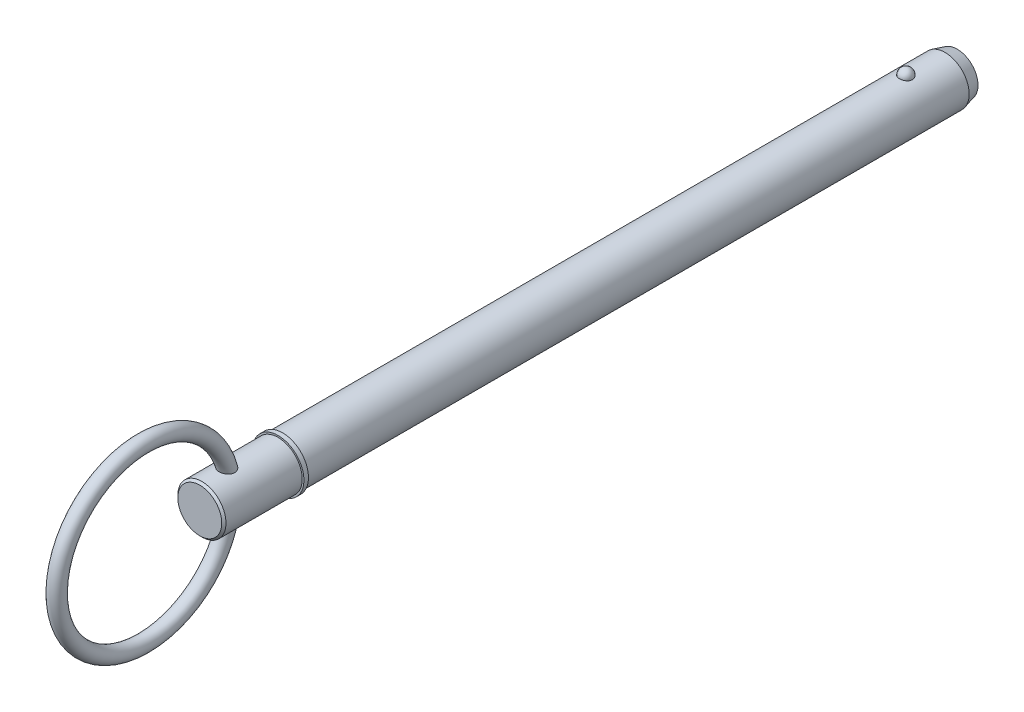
SolidWorks part; units mm, degrees
ref_plane "Front Plane" through (0, 0, 0) normal (0, 0, 1) x (1, 0, 0)
ref_plane "Top Plane" through (0, 0, 0) normal (0, 1, 0) x (1, 0, 0)
ref_plane "Right Plane" through (0, 0, 0) normal (1, 0, 0) x (0, 0, -1)
sketch "Sketch2" plane through (0, 0, 0) normal (0, 0, 1) x (1, 0, 0)
  circle A0 centre (0, 0) radius 7.94
  point P3 (0, 7.94)
  dimension "D1" = 15.88
extrude "Boss-Extrude1" add sketch "Sketch2" along normal blind 203.2
sketch "Sketch3" plane through (0, 0, 0) normal (0, 0, -1) x (-1, 0, 0)
  circle A0 centre (0, 0) radius 7.94
  dimension "D1" = 15.88
extrude "Boss-Extrude2" add sketch "Sketch3" along normal blind 19.05
chamfer "Chamfer1" distance 4 angle 15 1 edges at (-7.94, 0, -19.05)
sketch "Sketch18" plane through (0, 0, 0) normal (1, 0, 0) x (0, 0, -1)
  line L0 (15.05, 7.94) -> (-203.2, 7.94) construction
  line L1 (2.15, 10.09) -> (2.15, 5.79)
  line L2 (-203.2, -7.94) -> (15.05, -7.94) construction
  arc A0 (2.15, 10.09) -> (2.15, 5.79) centre (2.15, 7.94) ccw
  point P4 (0, 7.94)
  dimension "D1" = 18.03
revolve "Revolve1" add sketch "Sketch18" angle 360 about L1
sketch "Sketch19" plane through (0, 0, 0) normal (1, 0, 0) x (0, 0, -1)
  line L0 (-33.7288, 0) -> (-46.4542, 0) construction
sketch "Sketch20" plane through (0, 0, 0) normal (1, 0, 0) x (0, 0, -1)
  line L0 (-203.2, 0) -> (-203.2, 8.5)
  line L1 (-203.2, 7.94) -> (-203.2, -7.94) construction
  line L2 (-203.2, 8.5) -> (-204.7, 8.5)
  line L3 (-204.7, 8.5) -> (-204.7, 0)
  line L4 (-33.7288, 0) -> (-46.4542, 0) construction
  line L5 (-204.7, 0) -> (-203.2, 0)
  dimension "D1" = 8.5
  dimension "D2" = 1.5
revolve "Revolve2" add sketch "Sketch20" angle 360 about L0
sketch "Sketch21" plane through (0, 0, 203.2) normal (0, 0, -1) x (-1, 0, 0)
  circle A0 centre (0, 0) radius 7.94
  dimension "D1" = 15.88
extrude "Boss-Extrude3" add sketch "Sketch21" against normal blind 27.31
chamfer "Chamfer2" distance 0.7 angle 45 1 edges at (-7.94, 0, 230.51)
sketch "Sketch23" plane through (0, 0, 0) normal (1, 0, 0) x (0, 0, -1)
  line L0 (-230.51, 7.24) -> (-230.51, -7.24) construction
  circle A0 centre (-249.085, 0) radius 28.575
  point P2 (-220.51, 0)
  dimension "D1" = 57.15
  dimension "D2" = 10
sketch "Sketch24" plane through (0, 0, 0) normal (0, 1, 0) x (1, 0, 0)
  circle A0 centre (0, -220.51) radius 2.5
  dimension "D1" = 5
sweep "Sweep1" add profiles "Sketch24" path "Sketch23"
